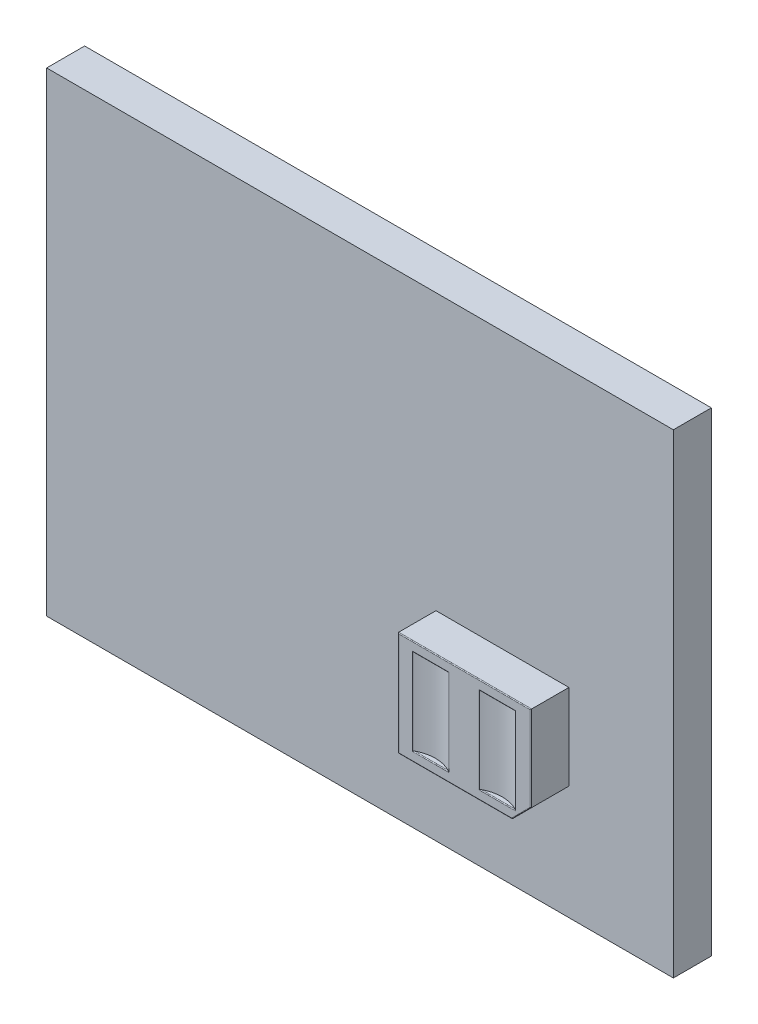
SolidWorks part; units mm, degrees
ref_plane "Face" through (0, 0, 0) normal (0, 0, 1) x (1, 0, 0)
ref_plane "Dessus" through (0, 0, 0) normal (0, 1, 0) x (1, 0, 0)
ref_plane "Droite" through (0, 0, 0) normal (1, 0, 0) x (0, 0, -1)
sketch "Esquisse1" plane through (0, 0, 0) normal (0, 0, 1) x (1, 0, 0)
  line L1 (-8.25, 6.25) -> (8.25, 6.25)
  line L2 (-8.25, 6.25) -> (-8.25, -6.25)
  line L3 (-8.25, -6.25) -> (8.25, -6.25)
  line L4 (8.25, 6.25) -> (8.25, -6.25)
  dimension "D1" = 6.25
  dimension "D2" = 12.5
  dimension "D3" = 8.25
  dimension "D4" = 16.5
extrude "Extrusion1" add sketch "Esquisse1" along normal blind 1
sketch "Esquisse3" plane through (0, 0, 0) normal (0, 0, 1) x (1, 0, 0)
  line L0 (2, -1) -> (5.5, -1)
  line L1 (5.5, -1) -> (5.5, -3.25)
  line L2 (5.5, -3.25) -> (5, -3.75)
  line L3 (5, -3.75) -> (2, -3.75)
  line L4 (2, -3.75) -> (2, -1)
  line L5 (-8.25, -6.25) -> (8.25, -6.25) construction
  line L6 (8.25, -6.25) -> (8.25, 6.25) construction
  dimension "D1" = 2.5
  dimension "D2" = 2.75
  dimension "D3" = 3.5
  dimension "D4" = 2.75
  dimension "D5" = 45
  dimension "D6" = 0.5
extrude "Extrusion2" add sketch "Esquisse3" along normal blind 2
ref_plane "Plan1" through (0, -3.5, 0) normal (0, -1, 0) x (1, 0, 0)
sketch "Esquisse4" plane through (0, -3.5, 0) normal (0, -1, 0) x (1, 0, 0)
  line L0 (3.7384, 2.8941) -> (3.7384, -0.6438) construction
  line L1 (2, 2) -> (5, 2) construction
  line L2 (2.3846, 2) -> (3.3348, 2)
  line L3 (5.0922, 2) -> (4.142, 2)
  line L4 (5, 2) -> (5.5, 2) construction
  arc A0 (2.3846, 2) -> (3.3348, 2) centre (2.8597, 2.8243) ccw
  arc A1 (5.0922, 2) -> (4.142, 2) centre (4.6171, 2.8243) cw
extrude "Enlèv. mat.-Extru.1" cut sketch "Esquisse4" against normal blind 2.25
fillet "Congé1" radius 0.02
sketch "Esquisse5"
